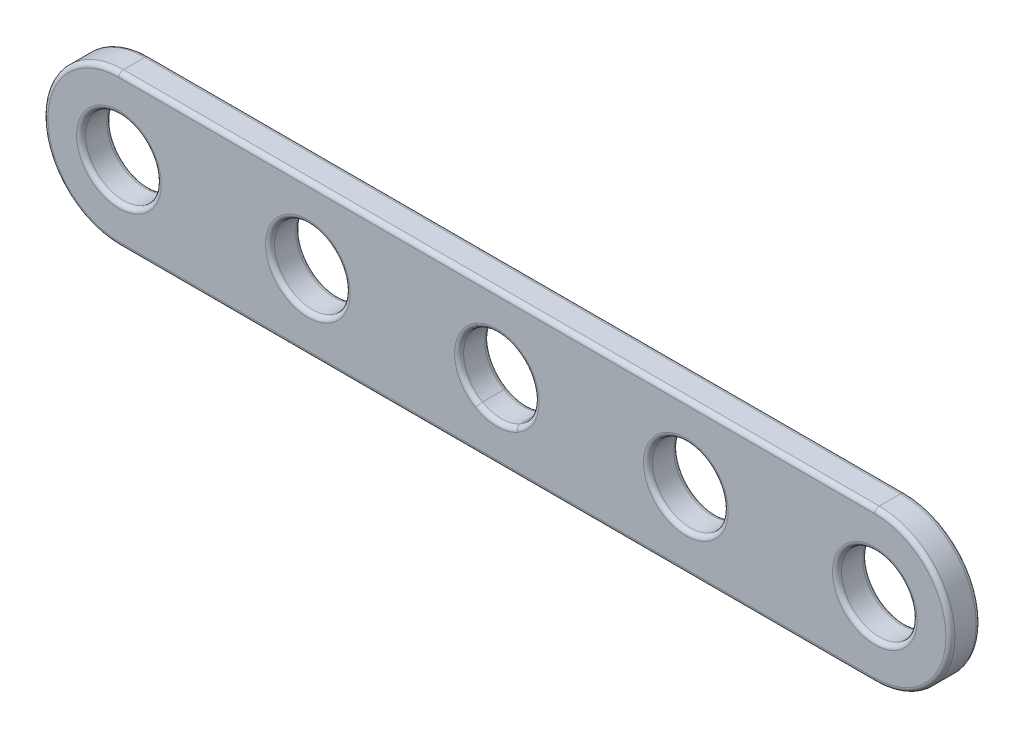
SolidWorks part; units mm, degrees
ref_plane "Front" through (0, 0, 0) normal (0, 0, 1) x (1, 0, 0)
ref_plane "Top" through (0, 0, 0) normal (0, 1, 0) x (1, 0, 0)
ref_plane "Right" through (0, 0, 0) normal (1, 0, 0) x (0, 0, -1)
sketch "Sketch1" plane through (0, 0, 0) normal (0, 0, 1) x (1, 0, 0)
  line L0 (250, 222.6284) -> (250, -151.5336) construction
  line L1 (0, 0) -> (500, 0)
  line L3 (0, 100) -> (500, 100)
  arc A0 (0, 100) -> (0, 0) centre (0, 50) ccw
  arc A1 (500, 100) -> (500, 0) centre (500, 50) cw
  point P1 (250, 0)
  point P10 (250, 100)
  dimension "D2" = 500
  dimension "D1" = 100
extrude "Base-Extrude" add sketch "Sketch1" along normal blind 20
sketch "Sketch2" plane through (0, 0, 20) normal (0, 0, 1) x (1, 0, 0)
  circle A0 centre (0, 50) radius 25
  arc A1 (0, 100) -> (0, 0) centre (0, 50) ccw construction
  dimension "D1" = 50
extrude "Cut-Extrude1" cut sketch "Sketch2" against normal through all
pattern_linear "LPattern1" count 5 spacing 125 along (1, 0, 0) of "Cut-Extrude1"
sketch "Sketch6" plane through (0, 0, 0) normal (0, 1, 0) x (1, 0, 0)
  line L0 (250, 24.303) -> (250, -37.3782) construction
  line L1 (250, 0) -> (250, -20) construction
  line L2 (500, -20) -> (0, -20) construction
  line L3 (500, 0) -> (0, 0) construction
  line L4 (262.5, -20) -> (237.5, -20)
  line L5 (262.5, 0) -> (237.5, 0)
  line L6 (262.5, 0) -> (262.5, -20)
  line L7 (237.5, 0) -> (237.5, -20)
  dimension "D1" = 25
fillet "Fillet1" radius 3 24 edges at (250, 100, 20) (550, 50, 20) (250, 0, 20) (-50, 50, 20) (25, 50, 20) (150, 50, 20) (400, 50, 20) (525, 50, 20) (250, 0, 0) (550, 50, 0) (250, 100, 0) (-50, 50, 0) (25, 50, 0) (150, 50, 0) (400, 50, 0) (525, 50, 0) (250, 75, 20) (275, 50, 20) (250, 25, 20) (225, 50, 20) (250, 75, 0) (225, 50, 0) (250, 25, 0) (275, 50, 0)
sketch "Sketch3" plane through (0, 0, 20) normal (0, 0, 1) x (1, 0, 0)
  line L0 (250, 189.4512) -> (250, -67.8587)
  circle A0 centre (0, 50) radius 25 construction
  dimension "D1" = 250
extrude "Cut-Extrude2" [suppressed] cut sketch "Sketch3" against normal through all and the other way through all
equation "\"D3@LPattern1\" = \"D2@Sketch1\" / (\"D1@LPattern1\"-1)"
